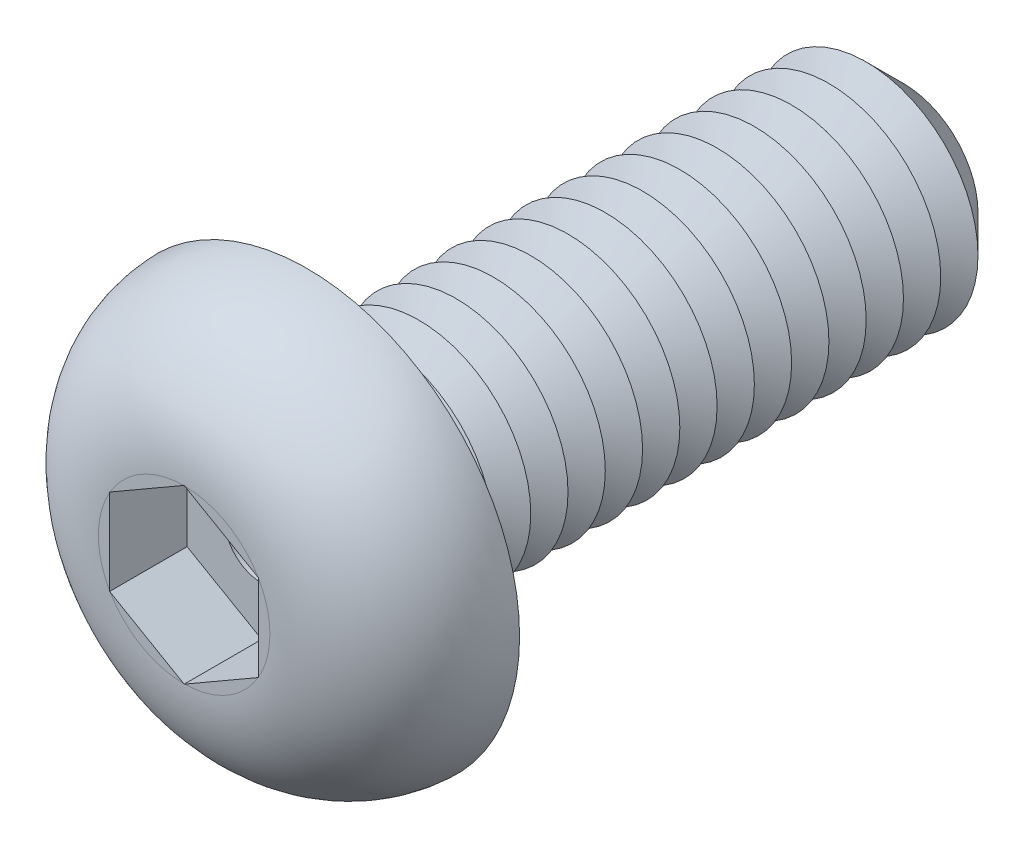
SolidWorks part; units mm, degrees
ref_plane "Front Plane" through (0, 0, 0) normal (0, 0, 1) x (1, 0, 0)
ref_plane "Top Plane" through (0, 0, 0) normal (0, 1, 0) x (1, 0, 0)
ref_plane "Right Plane" through (0, 0, 0) normal (1, 0, 0) x (0, 0, -1)
sketch "Sketch1" plane through (0, 0, 0) normal (1, 0, 0) x (0, 0, -1)
  line L0 (-47.9342, 0) -> (60.3146, 0) construction
sketch "Sketch2" plane through (0, 0, 0) normal (1, 0, 0) x (0, 0, -1)
  line L0 (0, 0) -> (-1.65, 0)
  line L1 (-47.9342, 0) -> (60.3146, 0) construction
  line L2 (-1.65, 0) -> (-1.65, 1.1507)
  line L3 (0, 2.85) -> (0, 0)
  arc A0 (-1.65, 1.1507) -> (0, 2.85) centre (0.05, 1.1507) cw
  dimension "D1" = 1.7
  dimension "D2" = 1.65
  dimension "D3" = 2.85
revolve "Revolve1" add sketch "Sketch2" angle 360 about L0
sketch "Sketch3" plane through (0, 0, 1.65) normal (0, 0, 1) x (1, 0, 0)
  line L1 (0, 1.1547) -> (-1, 0.5774)
  line L2 (-1, 0.5774) -> (-1, -0.5774)
  line L3 (-1, -0.5774) -> (0, -1.1547)
  line L4 (0, -1.1547) -> (1, -0.5774)
  line L5 (1, -0.5774) -> (1, 0.5774)
  line L6 (1, 0.5774) -> (0, 1.1547)
  circle A0 centre (0, 0) radius 1 construction
  dimension "D1" = 2
extrude "Cut-Extrude1" cut sketch "Sketch3" against normal blind 1.04
sketch "Sketch4" plane through (0, 0, 0) normal (0, 0, -1) x (-1, 0, 0)
  circle A0 centre (0, 0) radius 1.5
  dimension "D1" = 3
extrude "Boss-Extrude1" add sketch "Sketch4" along normal blind 8
chamfer "Chamfer1" distance 0.5 angle 45 1 edges at (-1.5, 0, -8)
sketch "Sketch5" plane through (0, 0, 0) normal (1, 0, 0) x (0, 0, -1)
  line L0 (0.5, 1.5) -> (1, 1.5)
  line L1 (7.5, 1.5) -> (0, 1.5) construction
  line L2 (1, 1.5) -> (0.75, 1.067)
  line L3 (0.75, 1.067) -> (0.5, 1.5)
  line L4 (0, -2.85) -> (0, 2.85) construction
  line L5 (7.5, 1.5) -> (0, 1.5) construction
  dimension "D1" = 0.5
  dimension "D2" = 0.5
revolve "Cut-Revolve1" cut sketch "Sketch5" angle 360 about L0
pattern_linear "LPattern1" count 14 spacing 0.5 along (0, 0, -1) of "Cut-Revolve1"
fillet "Fillet2" radius 0.25 1 edges at (1.5, 0, 0)
sketch "Sketch6" plane through (0, 0, 0.61) normal (0, 0, 1) x (1, 0, 0)
  circle A0 centre (0, 0) radius 0.5
  dimension "D1" = 1
extrude "Cut-Extrude2" cut sketch "Sketch6" against normal up to surface (8.61 mm away)
